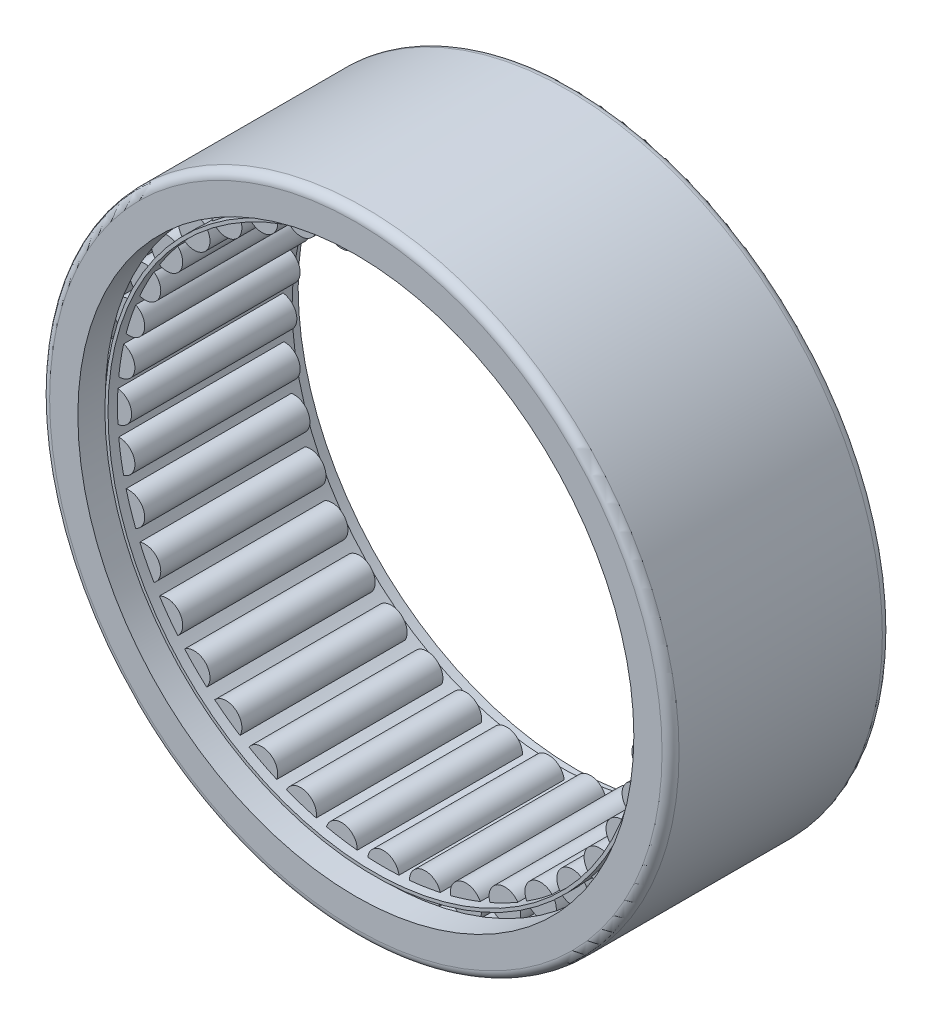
SolidWorks part; units mm, degrees
ref_plane "Front Plane" through (0, 0, 0) normal (0, 0, 1) x (1, 0, 0)
ref_plane "Top Plane" through (0, 0, 0) normal (0, 1, 0) x (1, 0, 0)
ref_plane "Right Plane" through (0, 0, 0) normal (1, 0, 0) x (0, 0, -1)
sketch "BaseSke" plane through (0, 0, 0) normal (1, 0, 0) x (0, 0, -1)
  line L0 (-47.2296, 0) -> (24.6132, 0) construction
  line L1 (-47.2296, 42.5) -> (24.6132, 42.5) construction
  line L2 (0, 129.5214) -> (0, -86.3012) construction
  line L3 (-13.125, 42.5) -> (-13.125, 45) construction
  line L4 (-17.5, 50) -> (17.5, 50) construction
  line L5 (-17.5, 35) -> (17.5, 35) construction
  line L6 (-13.125, 40) -> (13.125, 40)
  line L7 (-13.125, 40) -> (-13.125, 42.5)
  line L8 (-13.125, 42.5) -> (13.125, 42.5)
  line L9 (13.125, 40) -> (13.125, 42.5)
  line L10 (-13.125, 45) -> (13.125, 45) construction
  line L11 (13.125, 45) -> (13.125, 42.5) construction
  dimension "D2" = 26.25
  dimension "D1" = 85
  dimension "Bearing_Thickness" = 35
  dimension "Bearing_Outside_Diameter" = 100
  dimension "Bearing_Inside_Diameter" = 70
  dimension "Diameter_Fw" = 80
revolve "Roller" add sketch "BaseSke" angle 360 about L8
sketch "OuterRaceSke" plane through (0, 0, 0) normal (1, 0, 0) x (0, 0, -1)
  line L0 (0, 0) -> (0, 87.5396) construction
  line L1 (-17.5, 50) -> (17.5, 50)
  line L2 (-17.5, 50) -> (-17.5, 44.1667)
  line L3 (-17.5, 44.1667) -> (-13.15, 44.1667)
  line L4 (17.5, 50) -> (17.5, 44.1667)
  line L5 (-50.3916, 0) -> (55.2197, 0) construction
  line L6 (-13.125, 45) -> (13.125, 45) construction
  line L7 (13.15, 44.1667) -> (17.5, 44.1667)
  line L9 (-13.15, 44.1667) -> (-13.15, 44.98)
  line L10 (-13.15, 44.98) -> (13.15, 44.98)
  line L11 (13.15, 44.1667) -> (13.15, 44.98)
  dimension "D1" = 26.3
  dimension "D2" = 88.3333
  dimension "D3" = 0.02
revolve "OuterRace" add sketch "OuterRaceSke" angle 360 about L5
sketch "CageSke" plane through (0, 0, 0) normal (1, 0, 0) x (0, 0, -1)
  line L0 (-70.8626, 0) -> (113.5527, 0) construction
  line L1 (0, 58.441) -> (0, -70.8113) construction
  line L2 (-14.625, 42.25) -> (14.625, 42.25)
  line L3 (-14.625, 42.25) -> (-14.625, 42.75)
  line L4 (-33.2996, 42.5) -> (13.017, 42.5) construction
  line L5 (-47.2296, 42.5) -> (24.6132, 42.5) construction
  line L6 (0, 129.5214) -> (0, -86.3012) construction
  line L7 (-14.625, 42.75) -> (14.625, 42.75)
  line L9 (14.625, 42.25) -> (14.625, 42.75)
  point P17 (0, 42.25)
  dimension "D2" = 0.5
  dimension "D1" = 29.25
revolve "Cage" add sketch "CageSke" angle 360 about L0
fillet "Fillet1" radius 1.35 2 edges at (50, 0, -17.5) (50, 0, 17.5)
pattern_circular "CirPatternBall" count 40 over 360 about axis through (0, 0, 0) along (0, 0, 1) of "Roller"
sketch "SimplifiedSke" plane through (0, 0, 0) normal (1, 0, 0) x (0, 0, -1)
  line L0 (37.5911, 0) -> (-37.5911, 0) construction
  line L1 (-13.1351, 42.5) -> (13.151, 42.5) construction
  line L2 (-13.125, 45) -> (13.125, 45)
  line L3 (-13.125, 45) -> (-13.125, 40)
  line L4 (-13.125, 40) -> (13.125, 40)
  line L5 (13.125, 45) -> (13.125, 40)
  line L6 (-47.2296, 42.5) -> (24.6132, 42.5) construction
revolve "Simplified" [suppressed] add sketch "SimplifiedSke" angle 360 about L0
equation "\"D2@BaseSke\" = \"Bearing_Thickness@BaseSke\"*0.75"
equation "\"D1@BaseSke\" =  ( \"Bearing_Outside_Diameter@BaseSke\" + \"Bearing_Inside_Diameter@BaseSke\" )  / 2"
equation "\"D1@OuterRaceSke\" = \"Bearing_Thickness@BaseSke\"*0.75+0.05"
equation "\"D2@OuterRaceSke\" =\"D1@BaseSke\" +  ( \"D1@BaseSke\" - \"Diameter_Fw@BaseSke\" )  / 1.5"
equation "\"D1@CageSke\" = \"Bearing_Thickness@BaseSke\"*0.75+3"
equation "\"D2@CageSke\" = ( \"Bearing_Outside_Diameter@BaseSke\" - \"Diameter_Fw@BaseSke\" ) *0.025"
equation "\"D1@CirPatternBall\" =  int(  ( \"Bearing_Outside_Diameter@BaseSke\" + \"Bearing_Inside_Diameter@BaseSke\" )  / 2 *  pi  /  ( \"Bearing_Outside_Diameter@BaseSke\" - \"Bearing_Inside_Diameter@BaseSke\" ) * 4.5 "
